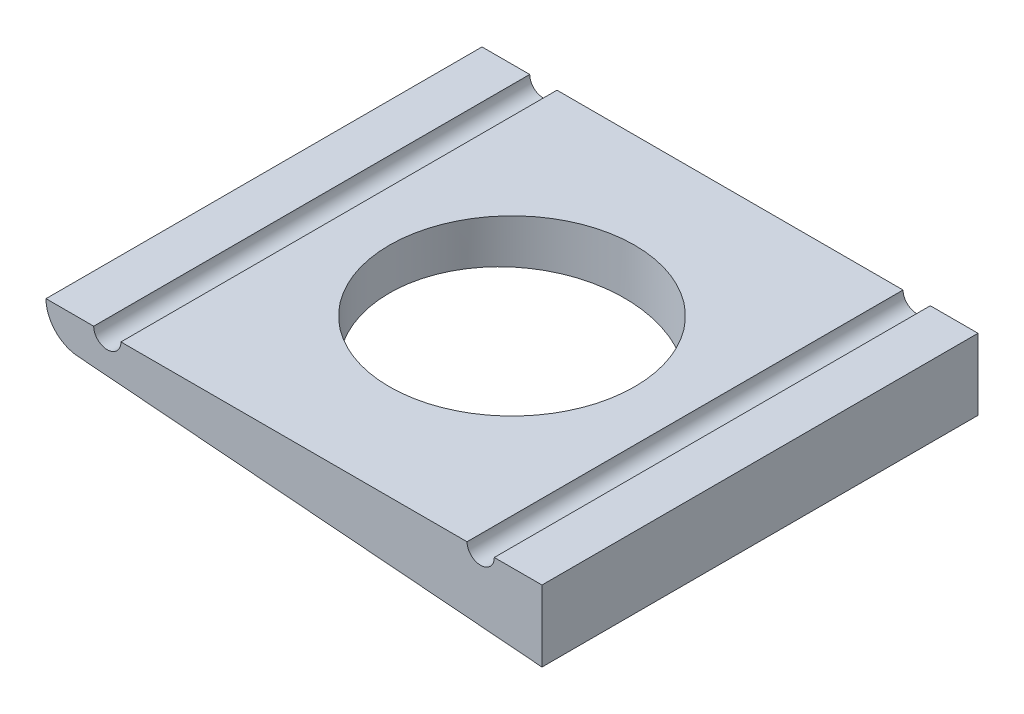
SolidWorks part; units mm, degrees
ref_plane "Plan de face" through (0, 0, 0) normal (0, 0, 1) x (1, 0, 0)
ref_plane "Plan de dessus" through (0, 0, 0) normal (0, 1, 0) x (1, 0, 0)
ref_plane "Plan de droite" through (0, 0, 0) normal (1, 0, 0) x (0, 0, -1)
sketch "Esquisse1" plane through (0, 0, 0) normal (0, 0, 1) x (1, 0, 0)
  line L0 (-12.7, 0) -> (12.7, 0)
  line L1 (14.7, 0) -> (18.2, 0)
  line L2 (0, 0) -> (0, -7.9291) construction
  line L3 (-14.7, 0) -> (-18.2, 0)
  line L4 (-15.8992, -2.4921) -> (18.2, -5.2176)
  line L5 (18.2, 0) -> (18.2, -5.2176)
  arc A0 (12.7, 0) -> (14.7, 0) centre (13.7, 0) ccw
  arc A1 (-12.7, 0) -> (-14.7, 0) centre (-13.7, 0) cw
  arc A2 (-18.2, 0) -> (-15.8992, -2.4921) centre (-15.7, 0) ccw
  dimension "D2" = 1
  dimension "D4" = 5
  dimension "D1" = 12.7
  dimension "D3" = 3.5
  dimension "D5" = 4.57
extrude "Extrusion1" add sketch "Esquisse1" along normal mid plane 32
sketch "Esquisse2" plane through (0, 0, 0) normal (0, 1, 0) x (-1, 0, 0)
  circle A0 centre (0, 0) radius 9
  dimension "D1" = 18
extrude "Enlèv. mat.-Extru.1" cut sketch "Esquisse2" against normal through all
